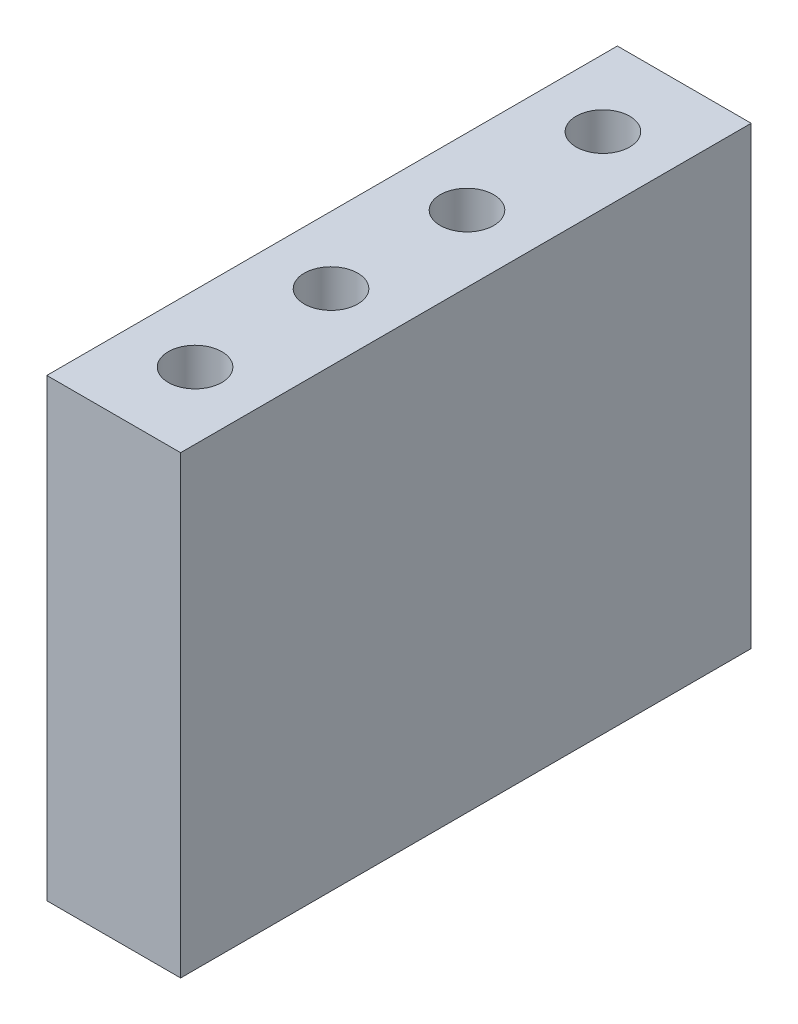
SolidWorks part; units mm, degrees
ref_plane "Front Plane" through (0, 0, 0) normal (0, 0, 1) x (1, 0, 0)
ref_plane "Top Plane" through (0, 0, 0) normal (0, 1, 0) x (1, 0, 0)
ref_plane "Right Plane" through (0, 0, 0) normal (1, 0, 0) x (0, 0, -1)
sketch "Sketch1" plane through (0, 0, 0) normal (0, 1, 0) x (1, 0, 0)
  line L0 (1.25, 10.66) -> (1.25, 0) construction
  line L1 (0, 0) -> (2.5, 0)
  line L2 (0, 0) -> (0, 10.66)
  line L3 (0, 10.66) -> (2.5, 10.66)
  line L4 (2.5, 0) -> (2.5, 10.66)
  line L5 (0, 5.33) -> (2.5, 5.33) construction
  dimension "D1" = 10.66
  dimension "D2" = 2.5
extrude "Extrude1" add sketch "Sketch1" along normal blind 8.5
sketch "Sketch2" plane through (0, 8.5, 0) normal (0, 1, 0) x (-1, 0, 0)
  line L0 (-1.25, 0) -> (-1.25, -10.66) construction
  line L1 (0, 0) -> (-2.5, 0) construction
  line L2 (-2.5, -10.66) -> (0, -10.66) construction
  line L3 (-2.5, -5.33) -> (0, -5.33) construction
  line L4 (-2.5, 0) -> (-2.5, -10.66) construction
  line L5 (0, -10.66) -> (0, 0) construction
  circle A0 centre (-1.25, -4.06) radius 0.5
  circle A1 centre (-1.25, -1.52) radius 0.5
  circle A6 centre (-1.25, -9.14) radius 0.5
  circle A7 centre (-1.25, -6.6) radius 0.5
  circle A8 centre (-1.25, 3.56) radius 0.5
  circle A9 centre (-1.25, 1.02) radius 0.5
  dimension "D1" = 1
  dimension "D2" = 2.54
  dimension "D3" = 2.54
extrude "Cut-Extrude1" cut sketch "Sketch2" against normal blind 6.38
sketch "Sketch3" plane through (0, 0, 0) normal (0, -1, 0) x (1, 0, 0)
  circle A1 centre (1.25, -1.52) radius 0.5 construction
  point P0 (1.25, -2.02)
